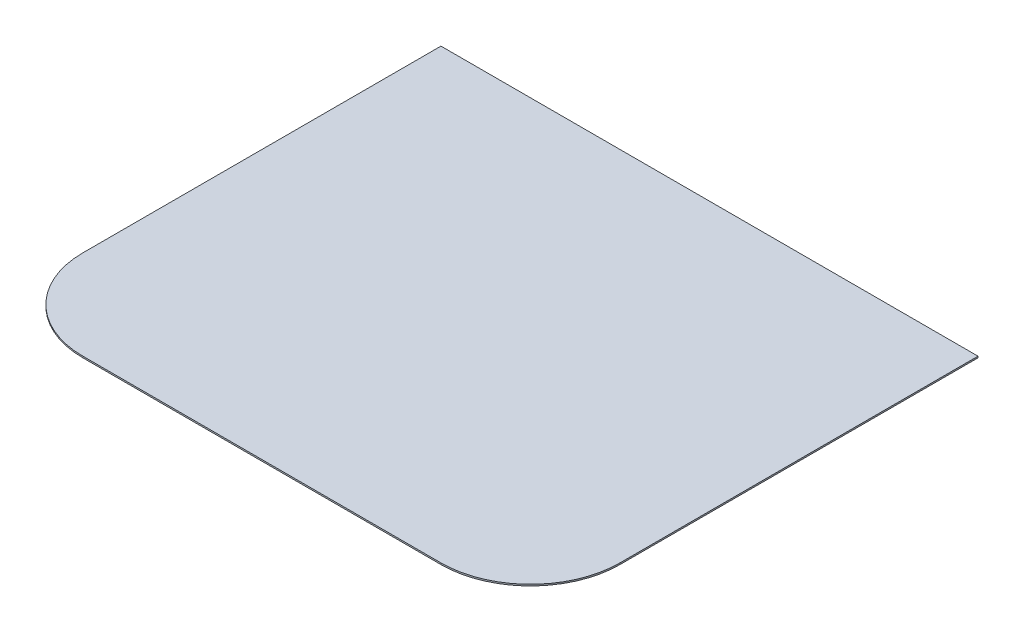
SolidWorks part; units mm, degrees
ref_plane "Front Plane" through (0, 0, 0) normal (0, 0, 1) x (1, 0, 0)
ref_plane "Top Plane" through (0, 0, 0) normal (0, 1, 0) x (1, 0, 0)
ref_plane "Right Plane" through (0, 0, 0) normal (1, 0, 0) x (0, 0, -1)
sketch "Sketch1" plane through (0, 0, 0) normal (0, 1, 0) x (1, 0, 0)
  line L1 (0, 0) -> (914.4, 0)
  line L2 (0, 0) -> (0, 762)
  line L3 (0, 762) -> (914.4, 762)
  line L4 (914.4, 0) -> (914.4, 762)
  dimension "D1" = 762
  dimension "D2" = 914.4
extrude "Boss-Extrude1" add sketch "Sketch1" along normal blind 2.54
sketch "Sketch2" plane through (0, 2.54, 0) normal (0, 1, 0) x (1, 0, 0)
  line L0 (0, 762) -> (0, 0) construction
  line L1 (0, 0) -> (914.4, 0) construction
  line L2 (0, 152.4) -> (0, 0)
  line L3 (0, 0) -> (152.4, 0)
  line L4 (457.2, 0) -> (457.2, -217.5305) construction
  line L5 (914.4, 0) -> (762, 0)
  line L6 (914.4, 152.4) -> (914.4, 0)
  arc A0 (0, 152.4) -> (152.4, 0) centre (152.4, 152.4) ccw
  arc A1 (914.4, 152.4) -> (762, 0) centre (762, 152.4) cw
  dimension "D2" = 152.4
  dimension "D3" = 152.4
extrude "Cut-Extrude1" cut sketch "Sketch2" against normal blind 2.54
sketch "Sketch3" plane through (0, 2.54, 0) normal (0, 1, 0) x (1, 0, 0)
  line L0 (914.4, 762) -> (0, 762) construction
  line L1 (0, 762) -> (0, 152.4) construction
  line L2 (457.2, 762) -> (457.2, 351.9103) construction
  circle A0 centre (508, 508) radius 38.1
  circle A1 centre (406.4, 508) radius 38.1
  dimension "D3" = 76.2
  dimension "D1" = 254
  dimension "D2" = 508
extrude "Cut-Extrude2" [suppressed] cut sketch "Sketch3" against normal blind 2.54
